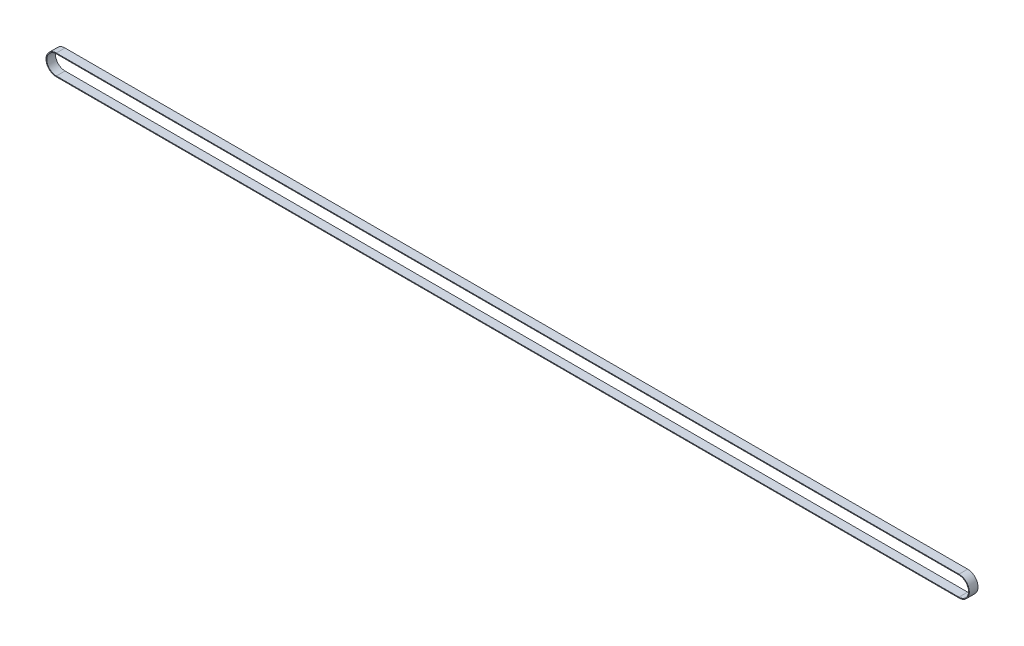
SolidWorks part; units mm, degrees
ref_plane "Front Plane" through (0, 0, 0) normal (0, 0, 1) x (1, 0, 0)
ref_plane "Top Plane" through (0, 0, 0) normal (0, 1, 0) x (1, 0, 0)
ref_plane "Right Plane" through (0, 0, 0) normal (1, 0, 0) x (0, 0, -1)
sketch "Sketch2" plane through (0, 0, 0) normal (0, 0, 1) x (1, 0, 0)
  line L0 (0, 0) -> (1, 0) construction
  line L1 (0, 0) -> (0, 1) construction
  line L2 (0, 28.65) -> (2598.5, 28.65)
  line L3 (2598.5, -28.65) -> (0, -28.65)
  arc A0 (0, -28.65) -> (0, 28.65) centre (0, 0) cw
  arc A1 (2598.5, 28.65) -> (2598.5, -28.65) centre (2598.5, 0) cw
sketch "Sketch4" plane through (0, 0, 0) normal (1, 0, 0) x (0, 0, -1)
  line L0 (0, 28.65) -> (0, -28.65) construction
  line L1 (-12.5, 29.75) -> (12.5, 29.75)
  line L2 (-12.5, 29.75) -> (-12.5, 27.55)
  line L3 (-12.5, 27.55) -> (12.5, 27.55)
  line L4 (12.5, 29.75) -> (12.5, 27.55)
  line L5 (-12.5, 29.75) -> (12.5, 27.55) construction
  line L6 (-12.5, 27.55) -> (12.5, 29.75) construction
  line L7 (0, 28.65) -> (0, -28.65) construction
  point P0 (0, 28.65)
  dimension "D1" = 2.2
  dimension "D2" = 25
  dimension "D3" = 12.5
  dimension "D4" = 28.65
sweep "Sweep1" add profiles "Sketch4" path "Sketch2"
